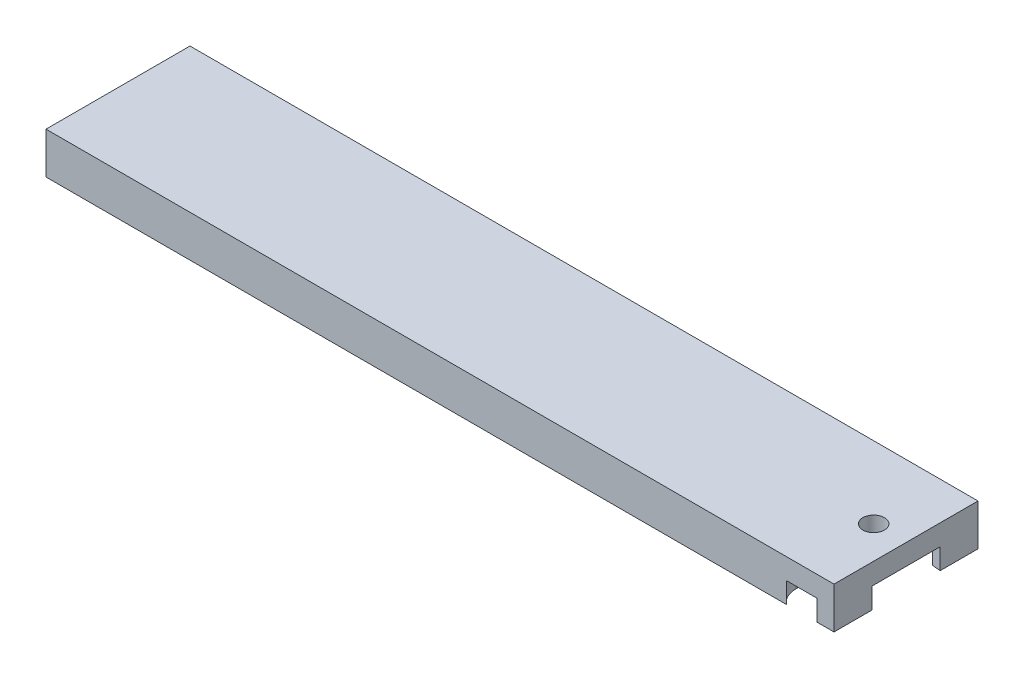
SolidWorks part; units mm, degrees
ref_plane "Plano frontal" through (0, 0, 0) normal (0, 0, 1) x (1, 0, 0)
ref_plane "Plano superior" through (0, 0, 0) normal (0, 1, 0) x (1, 0, 0)
ref_plane "Plano direito" through (0, 0, 0) normal (1, 0, 0) x (0, 0, -1)
sketch "Esboço1" plane through (0, 0, 0) normal (0, 1, 0) x (1, 0, 0)
  line L0 (0, 0) -> (-14.05, 0) construction
  line L1 (-14.1591, 1.997) -> (-2.2091, 2.65)
  line L2 (-2.2091, -2.65) -> (-14.1591, -1.997)
  arc A0 (-2.2091, -2.65) -> (-2.2091, 2.65) centre (0, 0) ccw
  arc A1 (-14.1591, 1.997) -> (-14.1591, -1.997) centre (-14.05, 0) ccw
  dimension "D1" = 6.9
  dimension "D2" = 4
  dimension "D3" = 19.5
  dimension "D4" = 5.3
extrude "Ressalto-extrusão1" add sketch "Esboço1" against normal blind 1.4
sketch "Esboço2" plane through (0, -1.4, 0) normal (0, -1, 0) x (1, 0, 0)
  arc A0 (-2.2091, -2.65) -> (-2.2091, 2.65) centre (0, 0) ccw construction
  circle A1 centre (0, 0) radius 3.45
extrude "Ressalto-extrusão2" add sketch "Esboço2" along normal offset from surface (2.4 mm away) 3.8
hole_wizard "Furo1" positions "Esboço9" profile "Esboço10" legacy
sketch "Esboço9" plane through (0, 0, 0) normal (0, 1, 0) x (1, 0, 0)
  line L1 (-14.45, 0) -> (0, 0) construction
  arc A2 (-14.1591, 1.997) -> (-14.1591, -1.997) centre (-14.05, 0) ccw construction
  point P0 (-14.45, 0)
  point P19 (-16.05, 0)
  dimension "D1" = 1.6
sketch "Esboço10" plane through (-14.45, 0, 0) normal (1, 0, 0) x (0, 0, 1)
  line L0 (0, 0) -> (0, 3.8)
  line L1 (0, 3.8) -> (0.6, 3.8)
  line L2 (0.6, 3.8) -> (0.6, 0)
  line L3 (0.6, 0) -> (0, 0)
  line L4 (0, 110) -> (0, -10) construction
  dimension "Diameter" = 1.2
  dimension "Depth" = 3.8
pattern_linear "Padrão linear1" count 6 spacing 2 along (1, 0, 0) of "Furo1"
sketch "Esboço12" plane through (0, 0, 0) normal (0, 1, 0) x (1, 0, 0)
  line L0 (0.3041, 3.4366) -> (16.6263, 1.9922)
  line L1 (16.6263, -1.9922) -> (0.3041, -3.4366)
  arc A0 (-2.2091, -2.65) -> (-2.2091, 2.65) centre (0, 0) ccw construction
  arc A1 (0.3041, -3.4366) -> (0.3041, 3.4366) centre (0, 0) ccw
  arc A2 (16.6263, 1.9922) -> (16.6263, -1.9922) centre (16.45, 0) cw
  arc A3 (-14.1591, 1.997) -> (-14.1591, -1.997) centre (-14.05, 0) ccw construction
  dimension "D1" = 2
  dimension "D2" = 34.5
extrude "Ressalto-extrusão3" add sketch "Esboço12" against normal up to surface (1.4 mm away)
hole_wizard "Furo2" positions "Esboço13" profile "Esboço14" legacy
sketch "Esboço13" plane through (0, 0, 0) normal (0, 1, 0) x (1, 0, 0)
  line L0 (0, 0) -> (16.85, 0) construction
  arc A0 (16.6263, -1.9922) -> (16.6263, 1.9922) centre (16.45, 0) ccw construction
  point P0 (16.85, 0)
  point P6 (18.45, 0)
  dimension "D1" = 1.6
sketch "Esboço14" plane through (16.85, 0, 0) normal (1, 0, 0) x (0, 0, 1)
  line L0 (0, 0) -> (0, 3.8)
  line L1 (0, 3.8) -> (0.6, 3.8)
  line L2 (0.6, 3.8) -> (0.6, 0)
  line L3 (0.6, 0) -> (0, 0)
  line L4 (0, 110) -> (0, -10) construction
  dimension "Diameter" = 1.2
  dimension "Depth" = 3.8
pattern_linear "Padrão linear2" count 7 spacing 2 along (-1, 0, 0) of "Furo2"
sketch "Esboço16" plane through (0, 0, 0) normal (0, 1, 0) x (1, 0, 0)
  line L0 (0, -6.45) -> (0, 6.45) construction
  line L1 (-1.9, -6.45) -> (-1.9, 6.45)
  line L2 (1.9, -6.45) -> (1.9, 6.45)
  arc A0 (-1.9, -6.45) -> (1.9, -6.45) centre (0, -6.45) ccw
  arc A1 (1.9, 6.45) -> (-1.9, 6.45) centre (0, 6.45) ccw
  point P2 (0, 0)
  dimension "D2" = 16.7
  dimension "D1" = 3.8
extrude "Ressalto-extrusão4" add sketch "Esboço16" against normal up to surface (1.4 mm away)
hole_wizard "Furo3" positions "Esboço17" profile "Esboço18" legacy
sketch "Esboço17" plane through (0, 0, 0) normal (0, 1, 0) x (1, 0, 0)
  point P0 (0, -6.45)
sketch "Esboço18" plane through (0, 0, 6.45) normal (1, 0, 0) x (0, 0, 1)
  line L0 (0, 0) -> (0, 3.8)
  line L1 (0, 3.8) -> (0.6, 3.8)
  line L2 (0.6, 3.8) -> (0.6, 0)
  line L3 (0.6, 0) -> (0, 0)
  line L4 (0, 110) -> (0, -10) construction
  dimension "Diameter" = 1.2
  dimension "Depth" = 3.8
pattern_linear "Padrão linear3" count 2 spacing 2 along (0, 0, -1) of "Furo3"
pattern_circular "PadrãoCircular1" count 2 over 360 about axis through (0, 0, 0) along (0, 1, 0) of "Padrão linear3", "Furo3"
hole_wizard "Furo4" positions "Esboço3" profile "Esboço4" legacy
sketch "Esboço3" plane through (0, -3.8, 0) normal (0, -1, 0) x (-1, 0, 0)
  point P0 (0, 0)
sketch "Esboço4" plane through (0, -3.8, 0) normal (1, 0, 0) x (0, 0, -1)
  line L0 (0, 0) -> (0, 2)
  line L1 (0, 2) -> (2.475, 2)
  line L2 (2.475, 2) -> (2.475, 0)
  line L3 (2.475, 0) -> (0, 0)
  line L4 (0, 110) -> (0, -10) construction
  dimension "Diameter" = 4.95
  dimension "Depth" = 2
hole_wizard "Furo5" positions "Esboço5" profile "Esboço6" legacy
sketch "Esboço5" plane through (0, 0, 0) normal (0, 1, 0) x (1, 0, 0)
  point P0 (0, 0)
sketch "Esboço6" plane through (0, 0, 0) normal (1, 0, 0) x (0, 0, 1)
  line L0 (0, 0) -> (0, 1)
  line L1 (0, 1) -> (2.3, 1)
  line L2 (2.3, 1) -> (2.3, 0)
  line L3 (2.3, 0) -> (0, 0)
  line L4 (0, 110) -> (0, -10) construction
  dimension "Diameter" = 4.6
  dimension "Depth" = 1
hole_wizard "Furo6" positions "Esboço7" profile "Esboço8" legacy
sketch "Esboço7" plane through (0, 0, 0) normal (0, 1, 0) x (1, 0, 0)
  point P0 (0, 0)
sketch "Esboço8" plane through (0, 0, 0) normal (1, 0, 0) x (0, 0, 1)
  line L0 (0, 0) -> (0, 3.8)
  line L1 (0, 3.8) -> (1.05, 3.8)
  line L2 (1.05, 3.8) -> (1.05, 0)
  line L3 (1.05, 0) -> (0, 0)
  line L4 (0, 110) -> (0, -10) construction
  dimension "Diameter" = 2.1
  dimension "Depth" = 3.8
sketch "Esboço11" plane through (0, -3.8, 0) normal (0, -1, 0) x (1, 0, 0)
  line L0 (-0.0981, 2.4731) -> (0, 2.375)
  line L1 (0, 2.375) -> (0.0981, 2.4731)
  line L2 (0, 0) -> (0, 2.475) construction
  circle A0 centre (0, 0) radius 2.375 construction
  circle A1 centre (0, 0) radius 2.475
  arc A2 (0.0981, 2.4731) -> (-0.0981, 2.4731) centre (0, 0) ccw
  dimension "D3" = 4.75
  dimension "D2" = 0.1
  dimension "D1" = 0
extrude "Ressalto-extrusão5" add sketch "Esboço11" against normal up to surface (2 mm away)
pattern_circular "PadrãoCircular2" count 60 over 360 about axis through (0, 0, 0) along (0, 1, 0) of "Ressalto-extrusão5"
sketch "Sketch1" plane through (0, 0, 0) normal (0, 1, 0) x (1, 0, 0)
  line L8 (-1.9, 6.45) -> (-1.9, 2.8797)
  line L9 (-2.2091, 2.65) -> (-14.1591, 1.997)
  line L10 (-14.1591, -1.997) -> (-2.2091, -2.65)
  line L11 (-1.9, -2.8797) -> (-1.9, -6.45)
  line L12 (1.9, -6.45) -> (1.9, -3.2953)
  line L13 (1.9, -3.2953) -> (16.6263, -1.9922)
  line L14 (16.6263, 1.9922) -> (1.9, 3.2953)
  line L15 (1.9, 3.2953) -> (1.9, 6.45)
  line L16 (-1.9, 6.45) -> (-1.9, 2.8797)
  line L17 (-2.2091, 2.65) -> (-14.1591, 1.997)
  line L18 (-14.1591, -1.997) -> (-2.2091, -2.65)
  line L19 (-1.9, -2.8797) -> (-1.9, -6.45)
  line L20 (1.9, -6.45) -> (1.9, -3.2953)
  line L21 (1.9, -3.2953) -> (16.6263, -1.9922)
  line L22 (16.6263, 1.9922) -> (1.9, 3.2953)
  line L23 (1.9, 3.2953) -> (1.9, 6.45)
  line L32 (8.9, 3.6798) -> (8.9, 8.6798)
  line L33 (8.9, 8.6798) -> (-91.1, 8.6798)
  line L34 (-91.1, 8.6798) -> (-91.1, -8.6798)
  line L35 (-91.1, -8.6798) -> (8.9, -8.6798)
  line L36 (8.9, -8.6798) -> (8.9, -3.6798)
  line L40 (-2.9, 6.45) -> (-2.9, 3.6137)
  line L41 (-2.9, 3.6137) -> (-14.2137, 2.9955)
  line L42 (-14.2137, -2.9955) -> (-2.9, -3.6137)
  line L43 (-2.9, -3.6137) -> (-2.9, -6.45)
  line L44 (2.9, -6.45) -> (2.9, -4.2108)
  line L45 (2.9, -4.2108) -> (16.7144, -2.9883)
  line L46 (16.7144, 2.9883) -> (2.9, 4.2108)
  line L47 (2.9, 4.2108) -> (2.9, 6.45)
  line L48 (-2.9, 6.45) -> (-2.9, 3.6137)
  line L49 (-2.9, 3.6137) -> (-14.2137, 2.9955)
  line L50 (-14.2137, -2.9955) -> (-2.9, -3.6137)
  line L51 (-2.9, -3.6137) -> (-2.9, -6.45)
  line L52 (2.9, -6.45) -> (2.9, -4.2108)
  line L53 (2.9, -4.2108) -> (16.7144, -2.9883)
  line L54 (16.7144, 2.9883) -> (2.9, 4.2108)
  line L55 (2.9, 4.2108) -> (2.9, 6.45)
  arc A8 (-1.9, 2.8797) -> (-2.2091, 2.65) centre (0, 0) ccw
  arc A9 (-14.1591, 1.997) -> (-14.1591, -1.997) centre (-14.05, 0) ccw
  arc A10 (-2.2091, -2.65) -> (-1.9, -2.8797) centre (0, 0) ccw
  arc A11 (-1.9, -6.45) -> (1.9, -6.45) centre (0, -6.45) ccw
  arc A12 (16.6263, -1.9922) -> (16.6263, 1.9922) centre (16.45, 0) ccw
  arc A13 (1.9, 6.45) -> (-1.9, 6.45) centre (0, 6.45) ccw
  arc A14 (-1.9, 2.8797) -> (-2.2091, 2.65) centre (0, 0) ccw
  arc A15 (-14.1591, 1.997) -> (-14.1591, -1.997) centre (-14.05, 0) ccw
  arc A16 (-2.2091, -2.65) -> (-1.9, -2.8797) centre (0, 0) ccw
  arc A17 (-1.9, -6.45) -> (1.9, -6.45) centre (0, -6.45) ccw
  arc A18 (16.6263, -1.9922) -> (16.6263, 1.9922) centre (16.45, 0) ccw
  arc A19 (1.9, 6.45) -> (-1.9, 6.45) centre (0, 6.45) ccw
  arc A30 (-14.2137, 2.9955) -> (-14.2137, -2.9955) centre (-14.05, 0) ccw
  arc A31 (-2.9, -6.45) -> (2.9, -6.45) centre (0, -6.45) ccw
  arc A32 (16.7144, -2.9883) -> (16.7144, 2.9883) centre (16.45, 0) ccw
  arc A33 (2.9, 6.45) -> (-2.9, 6.45) centre (0, 6.45) ccw
  arc A34 (-14.2137, 2.9955) -> (-14.2137, -2.9955) centre (-14.05, 0) ccw
  arc A35 (-2.9, -6.45) -> (2.9, -6.45) centre (0, -6.45) ccw
  arc A36 (16.7144, -2.9883) -> (16.7144, 2.9883) centre (16.45, 0) ccw
  arc A37 (2.9, 6.45) -> (-2.9, 6.45) centre (0, 6.45) ccw
  dimension "D1" = 0
  dimension "D3" = 5
  dimension "D4" = 5
  dimension "D5" = 6
  dimension "D6" = 100
  dimension "D2" = 1
extrude "Boss-Extrude1" add sketch "Sketch1" along normal blind 5 separate body contours A37 L33 L34 L35 A35 L51 L50 A34 L49 L48 | A37 L55 L54 L32 L33 | A35 L35 L36 L53 L52
sketch "Sketch2" plane through (0, 5, 0) normal (0, 1, 0) x (1, 0, 0)
  line L1 (-91.1, 8.6798) -> (8.9, 8.6798)
  line L2 (-91.1, 8.6798) -> (-91.1, -8.6798)
  line L3 (-91.1, -8.6798) -> (8.9, -8.6798)
  line L4 (8.9, 8.6798) -> (8.9, -8.6798)
extrude "Boss-Extrude2" add sketch "Sketch2" against normal blind 2.5
sketch "Sketch3" plane through (0, -1.8, 0) normal (0, -1, 0) x (1, 0, 0)
  circle A0 centre (0, 0) radius 1.3
  dimension "D1" = 2.6
extrude "Cut-Extrude1" cut sketch "Sketch3" against normal through all
sketch "Sketch4" plane through (0, 0, 0) normal (0, -1, 0) x (1, 0, 0)
  line L1 (-20.9627, 17.0491) -> (31.2088, 17.0491)
  line L2 (-20.9627, 17.0491) -> (-20.9627, -20.6638)
  line L3 (-20.9627, -20.6638) -> (31.2088, -20.6638)
  line L4 (31.2088, 17.0491) -> (31.2088, -20.6638)
extrude "Cut-Extrude2" cut sketch "Sketch4" along normal through all
sketch "Sketch5" plane through (0, 0, 0) normal (0, -1, 0) x (1, 0, 0)
  line L0 (-14.2137, 2.9955) -> (-21.7137, 2.5857)
  line L1 (-14.2137, -2.9955) -> (-21.7137, -2.5857)
  line L2 (-14.2137, 2.9955) -> (-2.9, 3.6137) construction
  line L3 (-2.9, -3.6137) -> (-14.2137, -2.9955) construction
  line L4 (-14.2137, 2.9955) -> (-14.2137, -2.9955)
  arc A0 (-21.7137, 2.5857) -> (-21.7137, -2.5857) centre (-21.7137, 0) ccw
  dimension "D1" = 180
  dimension "D2" = 180
  dimension "D3" = 7.5
  dimension "D4" = 7.5
extrude "Cut-Extrude3" cut sketch "Sketch5" against normal up to surface (2.5 mm away)
sketch "Sketch6" plane through (0, 0, 0) normal (0, -1, 0) x (1, 0, 0)
  line L0 (8.9, -8.6798) -> (1.8542, -8.6798) construction
  line L1 (8.9, 8.6798) -> (3.9, 8.6798)
  line L2 (8.9, 8.6798) -> (8.9, -8.6798)
  line L3 (8.9, -8.6798) -> (3.9, -8.6798)
  line L4 (3.9, 8.6798) -> (3.9, -8.6798)
  dimension "D1" = 5
extrude "Cut-Extrude5" cut sketch "Sketch6" against normal blind 10
